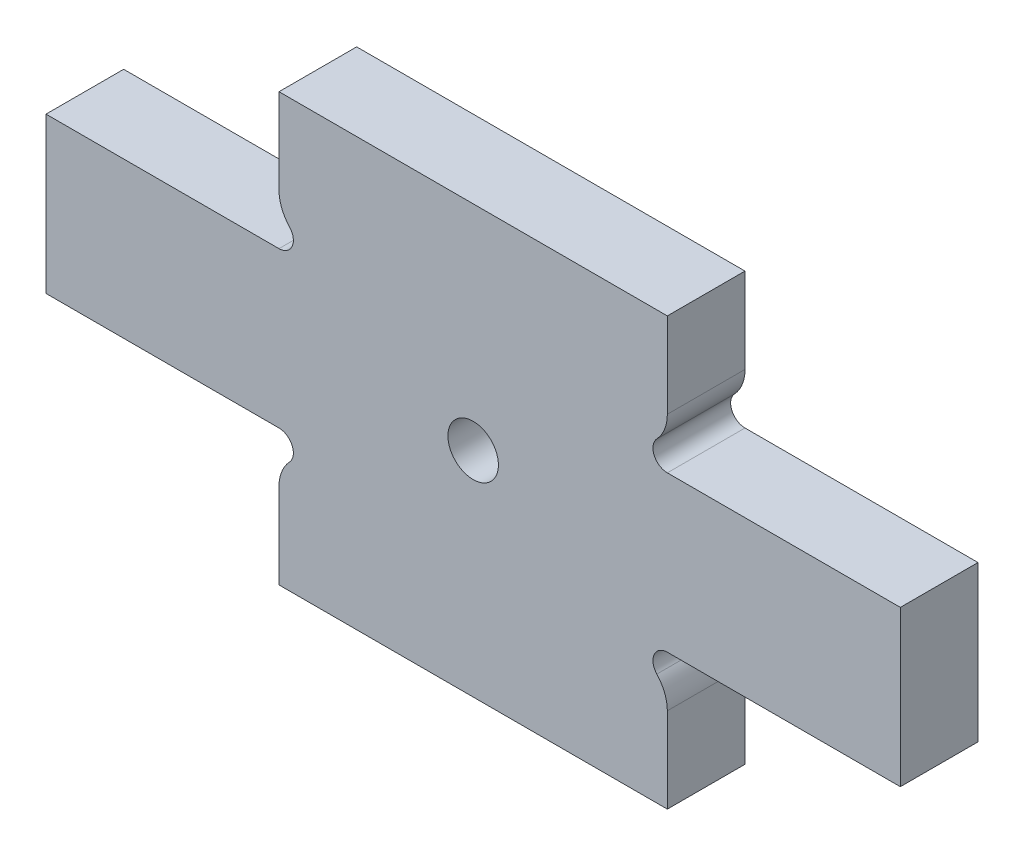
SolidWorks part; units mm, degrees
ref_plane "Plan de face" through (0, 0, 0) normal (0, 0, 1) x (1, 0, 0)
ref_plane "Plan de dessus" through (0, 0, 0) normal (0, 1, 0) x (1, 0, 0)
ref_plane "Plan de droite" through (0, 0, 0) normal (1, 0, 0) x (0, 0, -1)
sketch "Esquisse1" plane through (0, 0, 0) normal (0, 0, 1) x (1, 0, 0)
  line L0 (25, -10) -> (55, -10)
  line L1 (55, -10) -> (55, 10)
  line L2 (55, 10) -> (25, 10)
  line L3 (25, 16.5321) -> (25, 27.5)
  line L4 (25, 27.5) -> (-25, 27.5)
  line L5 (-25, 27.5) -> (-25, 16.5321)
  line L6 (-25, 10) -> (-55, 10)
  line L7 (-55, 10) -> (-55, -10)
  line L8 (-55, -10) -> (-25, -10)
  line L9 (-25, -16.5321) -> (-25, -27.5)
  line L10 (-25, -27.5) -> (25, -27.5)
  line L11 (25, -27.5) -> (25, -16.5321)
  arc A1 (25, -16.5321) -> (23.6496, -13.1145) centre (20, -16.5321) ccw
  arc A2 (25, -10) -> (23.6496, -13.1145) centre (25, -11.85) ccw
  arc A3 (23.6496, 13.1145) -> (25, 10) centre (25, 11.85) ccw
  arc A4 (23.6496, 13.1145) -> (25, 16.5321) centre (20, 16.5321) ccw
  arc A5 (-25, 16.5321) -> (-23.6496, 13.1145) centre (-20, 16.5321) ccw
  arc A6 (-25, 10) -> (-23.6496, 13.1145) centre (-25, 11.85) ccw
  arc A7 (-23.6496, -13.1145) -> (-25, -10) centre (-25, -11.85) ccw
  arc A8 (-23.6496, -13.1145) -> (-25, -16.5321) centre (-20, -16.5321) ccw
  dimension "D1" = 5
  dimension "D2" = 1.85
  dimension "D3" = 50
  dimension "D4" = 20
  dimension "D5" = 30
  dimension "D6" = 25
  dimension "D7" = 10
  dimension "D8" = 55
extrude "Boss.-Extru.1" add sketch "Esquisse1" along normal blind 10
sketch "Esquisse2" plane through (0, 0, 10) normal (0, 0, 1) x (1, 0, 0)
  circle A0 centre (0, 0) radius 3.25
  dimension "D1" = 6.5
extrude "Enlèv. mat.-Extru.1" cut sketch "Esquisse2" against normal blind 10
